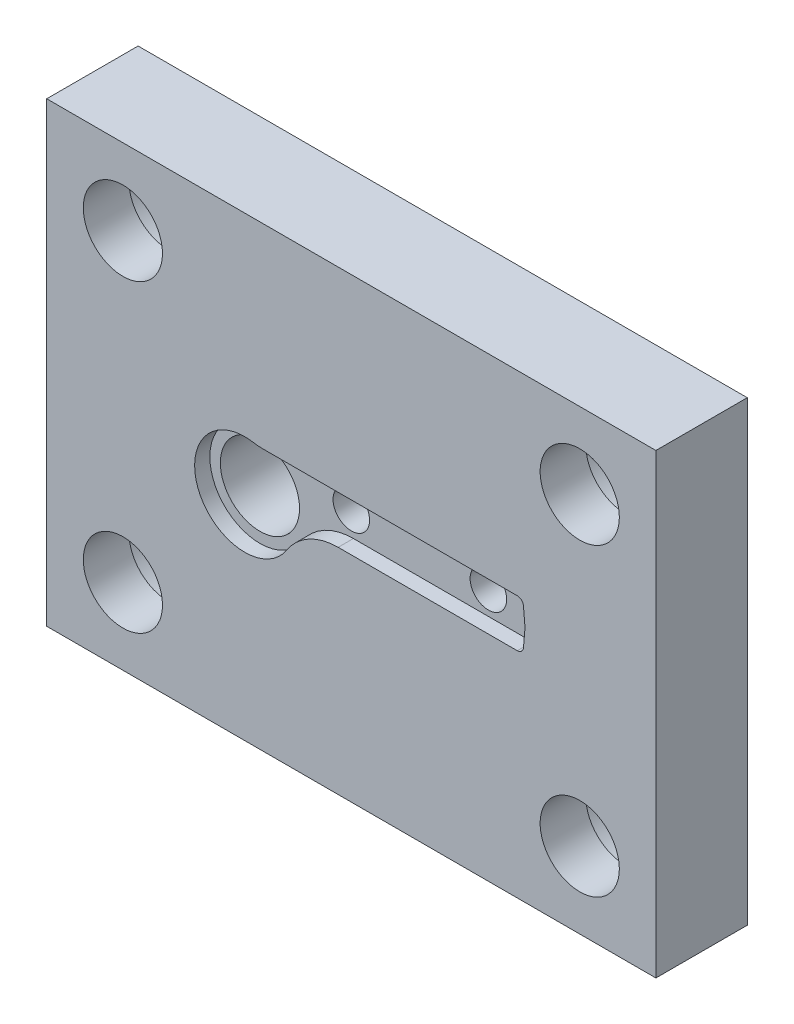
SolidWorks part; units mm, degrees
ref_plane "Plan1" through (0, 0, 0) normal (0, 0, 1) x (1, 0, 0)
ref_plane "Plan2" through (0, 0, 0) normal (0, 1, 0) x (1, 0, 0)
ref_plane "Plan3" through (0, 0, 0) normal (1, 0, 0) x (0, 0, -1)
sketch "Esquisse1" plane through (0, 0, 0) normal (0, 0, 1) x (1, 0, 0)
  line L1 (0, 0) -> (200, 0)
  line L2 (0, 0) -> (0, 150)
  line L3 (0, 150) -> (200, 150)
  line L4 (200, 0) -> (200, 150)
  dimension "D1" = 150
  dimension "D2" = 200
extrude "Base-Extrusion" add sketch "Esquisse1" along normal blind 30
sketch "Esquisse2" plane through (0, 0, 30) normal (0, 0, 1) x (1, 0, 0)
  line L0 (-10, 70) -> (90, 70) construction
  line L1 (0, 0) -> (200, 0) construction
  line L2 (20.3045, 78.12) -> (209.4484, 78.12) construction
  line L3 (71.0782, 85.935) -> (154.4898, 85.935)
  line L4 (156.5121, 84.0819) -> (157.0337, 78.12)
  line L5 (156.5121, 72.1581) -> (157.0337, 78.12)
  line L6 (95.6814, 70.305) -> (154.4898, 70.305)
  line L7 (200, 0) -> (200, 150) construction
  arc A0 (67.7404, 86.2151) -> (78.8329, 61.1069) centre (65, 70) ccw
  arc A1 (154.4898, 85.935) -> (156.5121, 84.0819) centre (154.4898, 83.905) cw
  arc A2 (71.0782, 85.935) -> (67.7404, 86.2151) centre (71.0782, 105.965) cw
  arc A3 (154.4898, 70.305) -> (156.5121, 72.1581) centre (154.4898, 72.335) ccw
  arc A4 (95.6814, 70.305) -> (78.8329, 61.1069) centre (95.6814, 50.275) ccw
  point P13 (156.35, 85.935)
  dimension "D2" = 32.89
  dimension "D6" = 91.35
  dimension "D7" = 2.03
  dimension "D8" = 20.03
  dimension "D9" = 20.03
  dimension "D10" = 135
  dimension "D1" = 70
  dimension "D3" = 8.12
  dimension "D4" = 7.815
  dimension "D5" = 95
extrude "Enlèv. mat.-Extru.1" cut sketch "Esquisse2" against normal blind 5
sketch "Esquisse3" plane through (0, 0, 25) normal (0, 0, 1) x (1, 0, 0)
  circle A0 centre (65, 70) radius 13
  dimension "D1" = 26
extrude "Enlèv. mat.-Extru.2" cut sketch "Esquisse3" against normal through all
sketch "Esquisse6" plane through (0, 0, 25) normal (0, 0, 1) x (1, 0, 0)
  line L0 (177.0279, 78.12) -> (94.3195, 78.12) construction
  line L1 (200, 0) -> (200, 150) construction
  circle A0 centre (140, 78.12) radius 6
  circle A1 centre (95, 78.12) radius 6
  dimension "D1" = 45
  dimension "D2" = 60
  dimension "D3" = 12
  dimension "D4" = 12
extrude "Enlèv. mat.-Extru.5" cut sketch "Esquisse6" against normal blind 13
sketch "Esquisse7" plane through (0, 0, 12) normal (0, 0, 1) x (1, 0, 0)
  circle A0 centre (140, 78.12) radius 9
  circle A1 centre (95, 78.12) radius 9
  dimension "D1" = 18
  dimension "D2" = 18
extrude "Enlèv. mat.-Extru.6" cut sketch "Esquisse7" against normal through all
sketch "Esquisse8" plane through (0, 0, 30) normal (0, 0, 1) x (1, 0, 0)
  line L1 (200, 0) -> (200, 150) construction
  line L2 (0, 0) -> (200, 0) construction
  circle A0 centre (25, 125) radius 13
  circle A1 centre (25, 25) radius 13
  circle A2 centre (175, 25) radius 13
  circle A3 centre (175, 125) radius 13
  dimension "D1" = 26
  dimension "D2" = 26
  dimension "D3" = 26
  dimension "D4" = 26
  dimension "D5" = 150
  dimension "D6" = 25
  dimension "D8" = 150
  dimension "D10" = 100
  dimension "D11" = 100
  dimension "D12" = 25
  dimension "D7" = 25
  dimension "D9" = 25
extrude "Enlèv. mat.-Extru.7" cut sketch "Esquisse8" against normal blind 15
sketch "Esquisse9" plane through (0, 0, 15) normal (0, 0, 1) x (1, 0, 0)
  circle A0 centre (25, 125) radius 20
  circle A1 centre (175, 125) radius 20
  circle A2 centre (175, 25) radius 20
  circle A3 centre (25, 25) radius 20
  dimension "D1" = 40
  dimension "D2" = 40
  dimension "D3" = 40
  dimension "D4" = 40
extrude "Enlèv. mat.-Extru.8" cut sketch "Esquisse9" against normal through all
